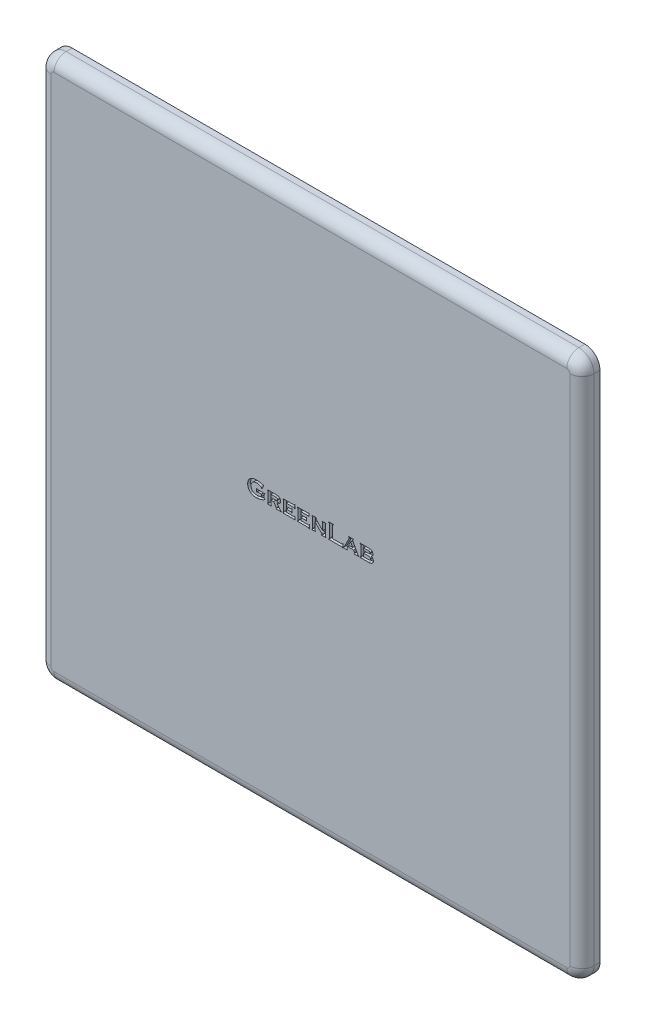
SolidWorks part; units mm, degrees
ref_plane "Front Plane" through (0, 0, 0) normal (0, 0, 1) x (1, 0, 0)
ref_plane "Top Plane" through (0, 0, 0) normal (0, 1, 0) x (1, 0, 0)
ref_plane "Right Plane" through (0, 0, 0) normal (1, 0, 0) x (0, 0, -1)
ref_plane "Plane1" through (0, 0, 3) normal (0, 0, 1) x (1, 0, 0)
sketch "Sketch1" plane through (0, 0, 3) normal (0, 0, 1) x (1, 0, 0)
  line L0 (-45.0365, 43.61) -> (-45.0365, -46.39)
  line L1 (-45.0365, -46.39) -> (44.9635, -46.39)
  line L2 (44.9635, -46.39) -> (44.9635, 43.61)
  line L3 (44.9635, 43.61) -> (-45.0365, 43.61)
  dimension "D1" = 90
  dimension "D2" = 90
extrude "Boss-Extrude1" add sketch "Sketch1" against normal blind 3
fillet "Fillet1" radius 2.5 4 edges at (-45.0365, -46.39, 1.5) (-45.0365, 43.61, 1.5) (44.9635, -46.39, 1.5) (44.9635, 43.61, 1.5)
fillet "Fillet2" radius 2 8 edges at (44.9635, -1.39, 3) (44.2313, -45.6578, 3) (44.2313, 42.8778, 3) (-0.0365, -46.39, 3) (-0.0365, 43.61, 3) (-44.3043, -45.6578, 3) (-44.3043, 42.8778, 3) (-45.0365, -1.39, 3)
sketch "Sketch2" plane through (0, 0, 3) normal (0, 0, 1) x (1, 0, 0)
  line L0 (-43.0365, -2.64) -> (42.9635, -2.64) construction
  line L1 (-43.0365, 41.11) -> (-43.0365, -43.89) construction
  line L2 (42.9635, -43.89) -> (42.9635, 41.11) construction
  line L3 (42.4635, -46.39) -> (-42.5365, -46.39) construction
  text T0 "GreenLab" font "Copperplate Gothic Bold" height 2.5
  dimension "D1" = 43.75
extrude "Cut-Extrude1" cut sketch "Sketch2" against normal blind 0.5
